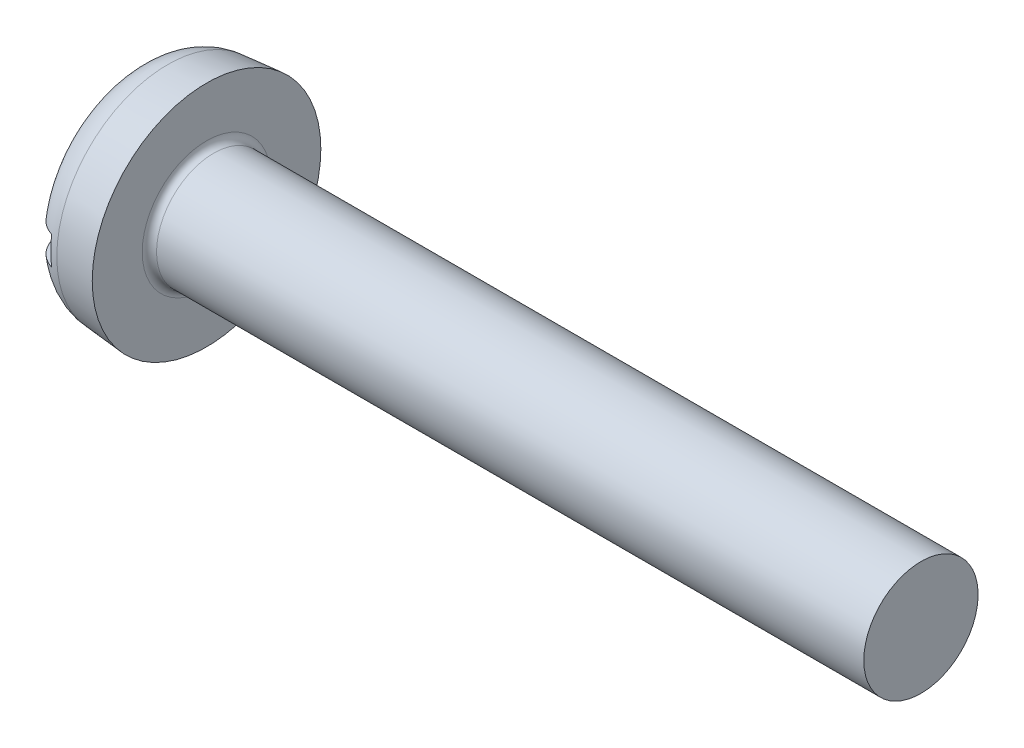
SolidWorks part; units mm, degrees
ref_plane "Front Plane" through (0, 0, 0) normal (0, 0, 1) x (1, 0, 0)
ref_plane "Top Plane" through (0, 0, 0) normal (0, 1, 0) x (1, 0, 0)
ref_plane "Right Plane" through (0, 0, 0) normal (1, 0, 0) x (0, 0, -1)
sketch "BodySke" plane through (0, 0, 0) normal (0, 0, 1) x (1, 0, 0)
  line L0 (0, 0) -> (19.6365, 0) construction
  line L1 (0, 0) -> (0, 1.5125)
  line L2 (0, 1.5125) -> (1, 1.6)
  line L3 (1, 1.6) -> (1, 0.8)
  line L4 (1, 0.8) -> (11, 0.8)
  line L5 (11, 0.8) -> (11, 0)
  line L6 (11, 0) -> (0, 0)
  line L7 (10.65, 0) -> (10.65, 0.8) construction
  line L8 (1, 0) -> (1, 0.8) construction
  point P12 (11, 0.601)
  dimension "Head_diameter" = 3.2
  dimension "Head_side_angle" = 5
  dimension "Head_Height" = 1
  dimension "Length" = 10
  dimension "Diameter" = 1.6
  dimension "Thread_length" = 10
  dimension "Advance" = 0.35
  dimension "Thread_minor" = 1.202
revolve "BaseBody" add sketch "BodySke" angle 360 about L0
fillet "Fillet1" radius 0.1 1 edges at (1, 0, 0.8)
fillet "Head_Radius" radius 0.5 1 edges at (0, 0, 1.5125)
sketch "SlotSke" plane through (0, 0, 0) normal (1, 0, 0) x (0, 0, -1)
  line L0 (-1.6, 0.2) -> (1.6, -0.2) construction
  line L1 (-1.6, 0.2) -> (1.6, 0.2)
  line L2 (-1.6, 0.2) -> (-1.6, -0.2)
  line L3 (-1.6, -0.2) -> (1.6, -0.2)
  line L4 (1.6, 0.2) -> (1.6, -0.2)
  dimension "D1" = 3.2
  dimension "Slot_width" = 0.4
extrude "Slot" cut sketch "SlotSke" along normal blind 0.35
sketch "ThdSchSke" plane through (0, 0, 0) normal (0, 0, 1) x (1, 0, 0)
  line L0 (10.8851, 1.0298) -> (10.8851, 0.8)
  line L1 (10.8851, 1.0298) -> (11.1149, 1.0298)
  line L2 (11.1149, 1.0298) -> (11.1149, 0.8)
  line L3 (11.1149, 0.8) -> (11, 0.601)
  line L4 (11, 0.601) -> (10.8851, 0.8)
  line L5 (1, 0.8) -> (11, 0.8) construction
  line L6 (0, 0) -> (12.5247, 0) construction
  line L7 (0, 0) -> (19.6365, 0) construction
revolve "ThreadSchematic" [suppressed] cut sketch "ThdSchSke" angle 360 about L6
pattern_linear "ThdSchPat" [suppressed]
equation "\"Thread_minor@ThreadCosmetic\" = \"Thread_minor@BodySke\""
equation "\"Thread_length@ThreadCosmetic\" = \"Thread_length@BodySke\""
equation "\"D1@SlotSke\" = \"Head_diameter@BodySke\""
equation "\"Advance@ThdSchPat\" = \"Advance@BodySke\""
equation "\"Tooth_Num@ThdSchPat\" =  int( \"Thread_length@BodySke\" / \"Advance@BodySke\" ) "
